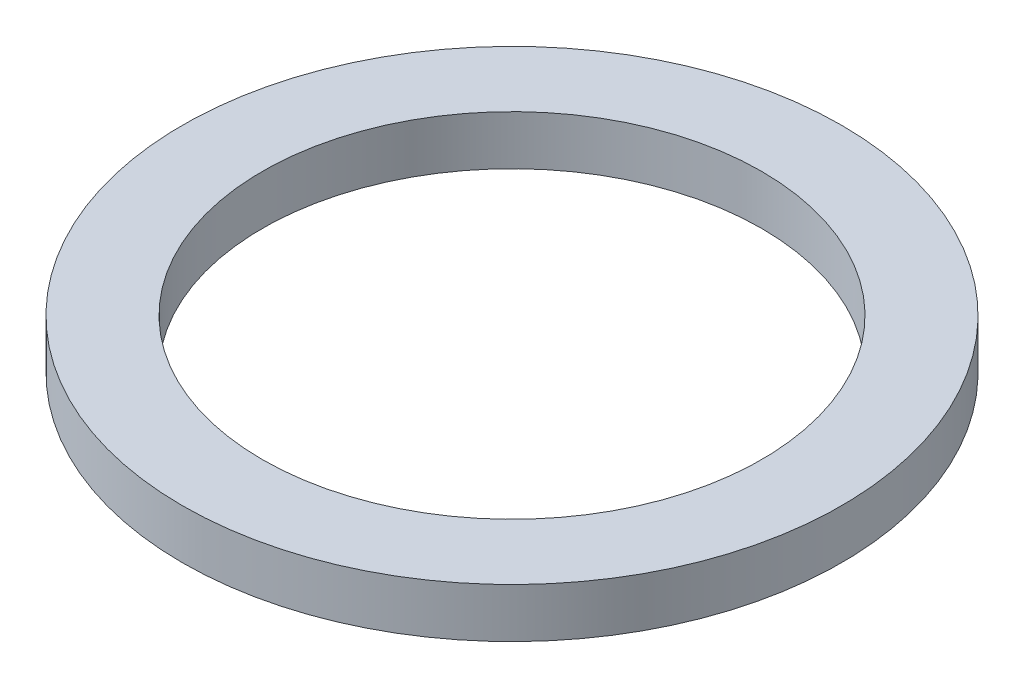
SolidWorks part; units mm, degrees
ref_plane "Front Plane" through (0, 0, 0) normal (0, 0, 1) x (1, 0, 0)
ref_plane "Top Plane" through (0, 0, 0) normal (0, 1, 0) x (1, 0, 0)
ref_plane "Right Plane" through (0, 0, 0) normal (1, 0, 0) x (0, 0, -1)
sketch "Sketch1" plane through (0, 0, 0) normal (0, 1, 0) x (1, 0, 0)
  circle A0 centre (0, 0) radius 15.15
  circle A1 centre (0, 0) radius 20
  dimension "D1" = 40
  dimension "D2" = 30.3
extrude "Boss-Extrude1" add sketch "Sketch1" along normal blind 3
